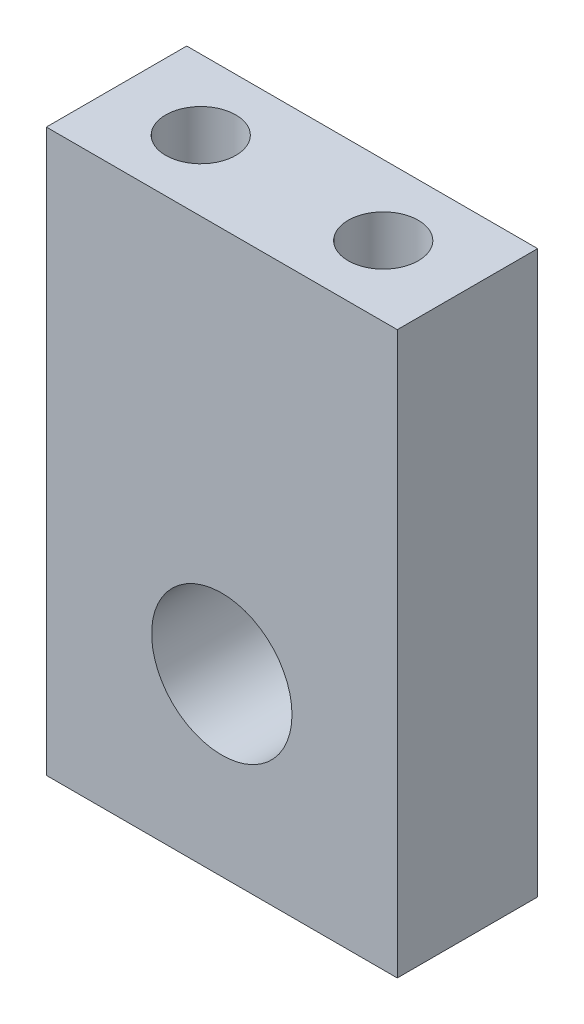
SolidWorks part; units mm, degrees
ref_plane "Plan de face" through (0, 0, 0) normal (0, 0, 1) x (1, 0, 0)
ref_plane "Plan de dessus" through (0, 0, 0) normal (0, 1, 0) x (1, 0, 0)
ref_plane "Plan de droite" through (0, 0, 0) normal (1, 0, 0) x (0, 0, -1)
sketch "Esquisse1" plane through (0, 0, 0) normal (0, 0, 1) x (1, 0, 0)
  line L1 (12.5, 20) -> (-12.5, 20)
  line L2 (12.5, 20) -> (12.5, -20)
  line L3 (12.5, -20) -> (-12.5, -20)
  line L4 (-12.5, 20) -> (-12.5, -20)
  line L5 (12.5, 20) -> (-12.5, -20) construction
  line L6 (12.5, -20) -> (-12.5, 20) construction
  point P0 (0, 0)
  dimension "D1" = 40
  dimension "D2" = 25
extrude "Boss.-Extru.1" add sketch "Esquisse1" along normal blind 10
sketch "Esquisse2" plane through (0, 0, 10) normal (0, 0, 1) x (1, 0, 0)
  line L0 (-12.5, 20) -> (-12.5, -20) construction
  line L1 (-12.5, -20) -> (12.5, -20) construction
  circle A0 centre (0, -7.5) radius 5
  dimension "D1" = 10
  dimension "D3" = 12.5
  dimension "D2" = 12.5
extrude "Enlèv. mat.-Extru.1" cut sketch "Esquisse2" against normal blind 10
hole_wizard "Trou taraudé M6x1.01" positions "Esquisse4" profile "Esquisse5" tap size "M6x1.0" standard "Ansi Metric"
sketch "Esquisse4" plane through (0, 20, 0) normal (0, 1, 0) x (1, 0, 0)
  line L0 (-12.5, -10) -> (-12.5, 0) construction
  line L1 (12.5, -10) -> (12.5, 0) construction
  line L2 (12.5, -10) -> (-12.5, -10) construction
  point P0 (-6.5, -5)
  point P2 (6.5, -5)
  dimension "D1" = 6
  dimension "D2" = 6
  dimension "D3" = 5
  dimension "D4" = 5
sketch "Esquisse5" plane through (-6.5, 20, 5) normal (1, 0, 0) x (0, 0, 1)
  line L0 (0, 0) -> (0, 18.5022)
  line L1 (0, 18.5022) -> (2.5, 17)
  line L2 (2.5, 17) -> (2.5, 0)
  line L5 (2.5, 0) -> (0, 0)
  line L10 (0, 18.5022) -> (-2.5, 17) construction
  line L11 (0, -6.35) -> (0, 107.95) construction
  dimension "Diamètre du trou pour taraudage" = 5
  dimension "Profondeur du trou pour taraudage" = 17
  dimension "Angle de pointe" = 118
